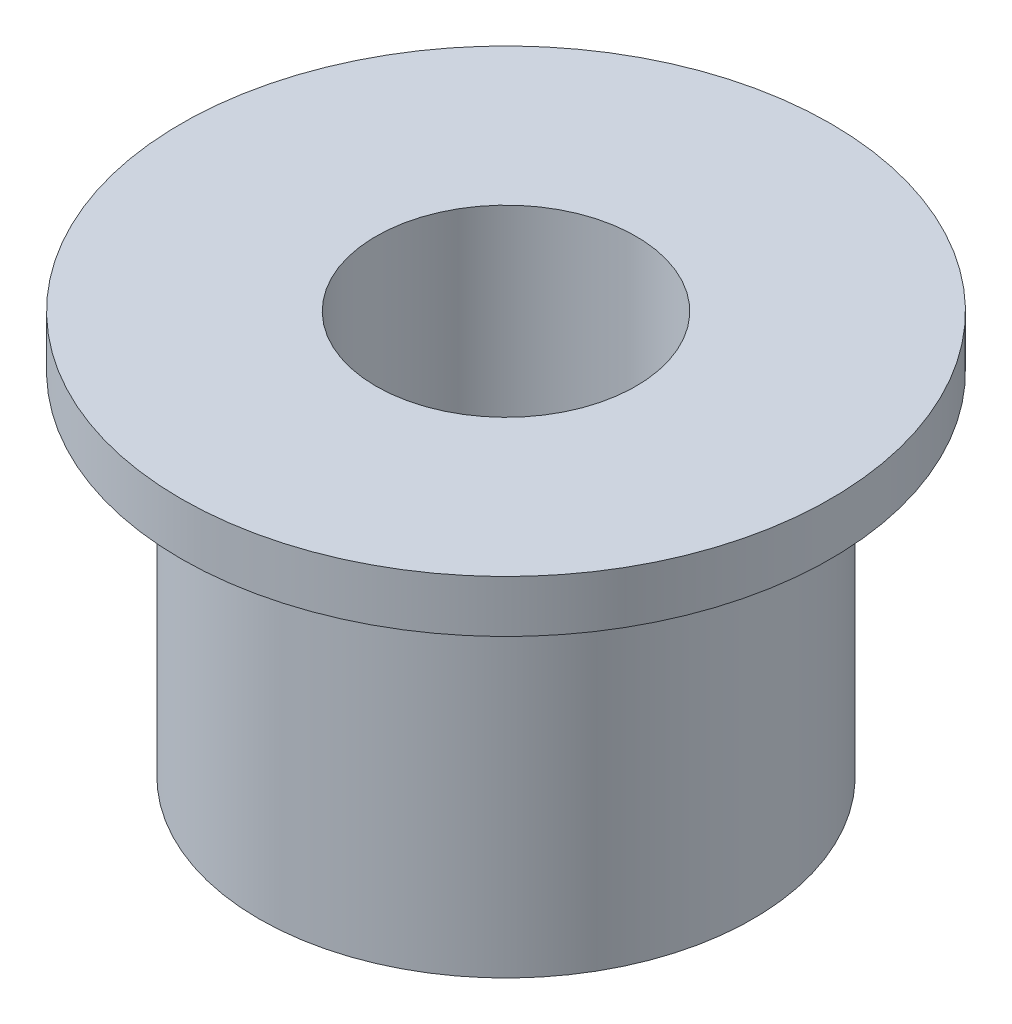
SolidWorks part; units mm, degrees
ref_plane "Front Plane" through (0, 0, 0) normal (0, 0, 1) x (1, 0, 0)
ref_plane "Top Plane" through (0, 0, 0) normal (0, 1, 0) x (1, 0, 0)
ref_plane "Right Plane" through (0, 0, 0) normal (1, 0, 0) x (0, 0, -1)
sketch "Sketch1" plane through (0, 0, 0) normal (0, 0, 1) x (1, 0, 0)
  line L0 (10, 31) -> (25, 31)
  line L1 (25, 31) -> (25, 27)
  line L2 (25, 27) -> (19, 27)
  line L3 (19, 27) -> (19, 0)
  line L4 (19, 0) -> (10, 0)
  line L5 (10, 0) -> (10, 31)
  line L6 (0, 38.1) -> (0, -50.8) construction
  dimension "D1" = 10
  dimension "D2" = 25
  dimension "D3" = 4
  dimension "D4" = 31
  dimension "D5" = 19
revolve "Revolve1" add sketch "Sketch1" angle 360 about L6
